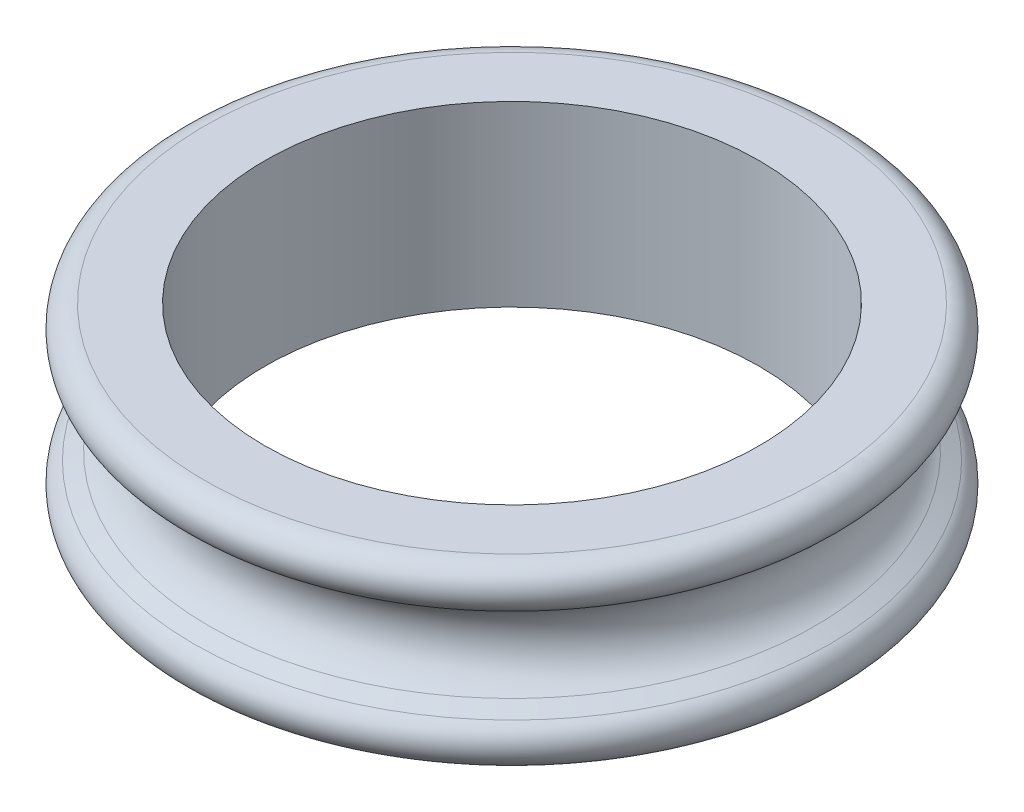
SolidWorks part; units mm, degrees
ref_plane "Front Plane" through (0, 0, 0) normal (0, 0, 1) x (1, 0, 0)
ref_plane "Top Plane" through (0, 0, 0) normal (0, 1, 0) x (1, 0, 0)
ref_plane "Right Plane" through (0, 0, 0) normal (1, 0, 0) x (0, 0, -1)
sketch "Sketch1" plane through (0, 0, 0) normal (0, 1, 0) x (1, 0, 0)
  line L0 (0, 0) -> (0, 16.5276) construction
  circle A0 centre (0, 0) radius 11.1
  circle A1 centre (0, 0) radius 12.5
  dimension "D1" = 22.2
  dimension "D2" = 25
extrude "Boss-Extrude1" add sketch "Sketch1" along normal blind 8
sketch "Sketch2" plane through (0, 0, 0) normal (1, 0, 0) x (0, 0, -1)
  line L0 (12.5, 8) -> (13.8012, 8)
  line L1 (12.5, 4) -> (17.8633, 4) construction
  line L2 (14.2799, 1.878) -> (13.6085, 2.244)
  line L3 (12.5, 0) -> (12.5, 8) construction
  line L4 (12.5, 0) -> (13.8012, 0)
  line L5 (14.2799, 6.122) -> (13.6085, 5.756)
  line L6 (12.5, 8) -> (12.5, 0)
  line L7 (0, 0) -> (0, 8.306) construction
  arc A0 (13.6085, 5.756) -> (13.6085, 2.244) centre (14.5659, 4) ccw
  arc A1 (13.8012, 8) -> (14.2799, 6.122) centre (13.8012, 7) cw
  arc A2 (13.8012, 0) -> (14.2799, 1.878) centre (13.8012, 1) ccw
  dimension "D1" = 2
  dimension "D2" = 1
revolve "Revolve1" add sketch "Sketch2" angle 360 about L7
